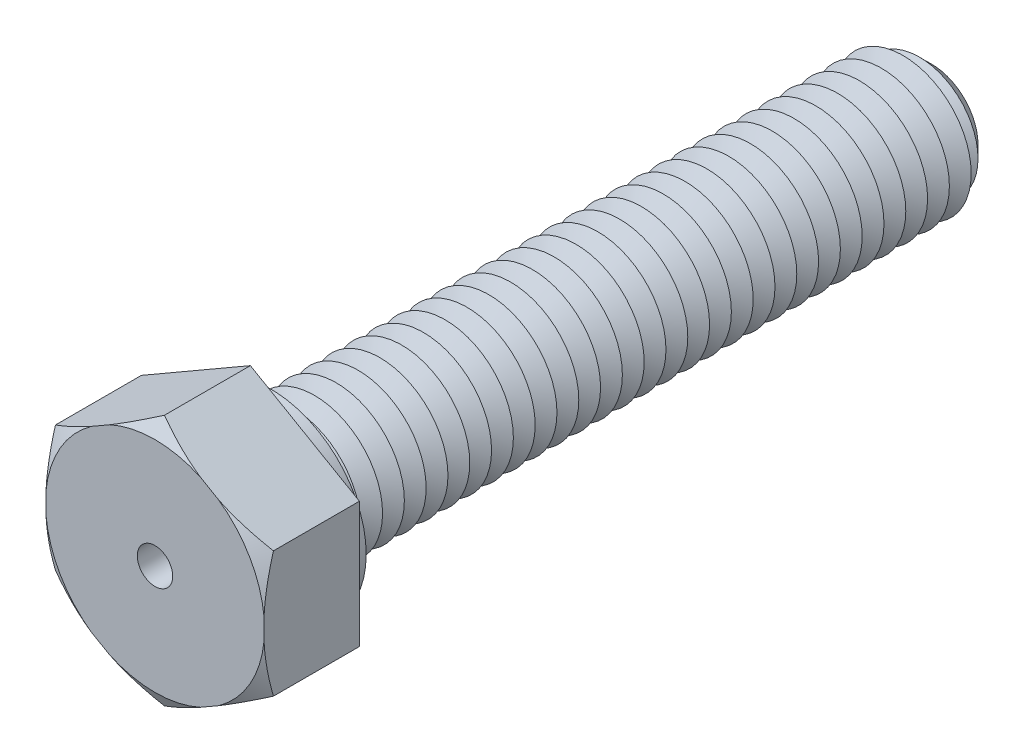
SolidWorks part; units mm, degrees
ref_plane "Front Plane" through (0, 0, 0) normal (0, 0, 1) x (1, 0, 0)
ref_plane "Top Plane" through (0, 0, 0) normal (0, 1, 0) x (1, 0, 0)
ref_plane "Right Plane" through (0, 0, 0) normal (1, 0, 0) x (0, 0, -1)
sketch "Sketch2" plane through (0, 0, 0) normal (0, 0, 1) x (1, 0, 0)
  line L1 (0, 4.6188) -> (-4, 2.3094)
  line L2 (-4, 2.3094) -> (-4, -2.3094)
  line L3 (-4, -2.3094) -> (0, -4.6188)
  line L4 (0, -4.6188) -> (4, -2.3094)
  line L5 (4, -2.3094) -> (4, 2.3094)
  line L6 (4, 2.3094) -> (0, 4.6188)
  circle A0 centre (0, 0) radius 4 construction
  dimension "D1" = 8
extrude "Boss-Extrude1" add sketch "Sketch2" along normal blind 3.5
sketch "Sketch3" plane through (0, 0, 0) normal (0, 0, -1) x (-1, 0, 0)
  circle A0 centre (0, 0) radius 2.5
  dimension "D1" = 5
extrude "Boss-Extrude2" add sketch "Sketch3" along normal blind 25
sketch "Sketch4" plane through (0, 0, 0) normal (0, 0, -1) x (-1, 0, 0)
  circle A0 centre (0, 0) radius 3.5
  dimension "D1" = 7
extrude "Boss-Extrude3" add sketch "Sketch4" along normal blind 0.75
sketch "Sketch5" plane through (0, 0, 0) normal (1, 0, 0) x (0, 0, -1)
  line L0 (-3.2117, 0) -> (6.3192, 0) construction
chamfer "Chamfer1" distance 0.8 angle 45 1 edges at (-2.5, 0, -25)
sketch "Sketch6" plane through (0, 0, 0) normal (1, 0, 0) x (0, 0, -1)
  line L0 (0.75, 2.5) -> (1.15, 1.8072)
  line L1 (1.15, 1.8072) -> (1.55, 2.5)
  line L2 (24.2, 2.5) -> (0.75, 2.5) construction
  line L3 (1.55, 2.5) -> (0.75, 2.5)
  dimension "D1" = 0.8
revolve "Cut-Revolve1" cut sketch "Sketch6" angle 360 about L0
pattern_linear "LPattern1" count 30 spacing 0.8 along (0, 0, -1) of "Cut-Revolve1"
sketch "Sketch7" plane through (0, 0, 0) normal (1, 0, 0) x (0, 0, -1)
  line L0 (-3.5, 4.6188) -> (-3.5, 4.0188)
  line L1 (-3.5, 2.3094) -> (-3.5, 4.6188) construction
  line L2 (-3.5, 4.0188) -> (-3.1536, 4.6188)
  line L3 (-3.5, 4.6188) -> (0, 4.6188) construction
  line L4 (-3.1536, 4.6188) -> (-3.5, 4.6188)
  dimension "D1" = 0.6
  dimension "D2" = 30
revolve "Cut-Revolve2" cut sketch "Sketch7" angle 360 about L0
sketch "Sketch8" plane through (0, 0, 3.5) normal (0, 0, 1) x (1, 0, 0)
  circle A0 centre (0, 0) radius 0.65
  dimension "D1" = 1.3
extrude "Cut-Extrude1" cut sketch "Sketch8" against normal up to surface (28.5 mm away)
